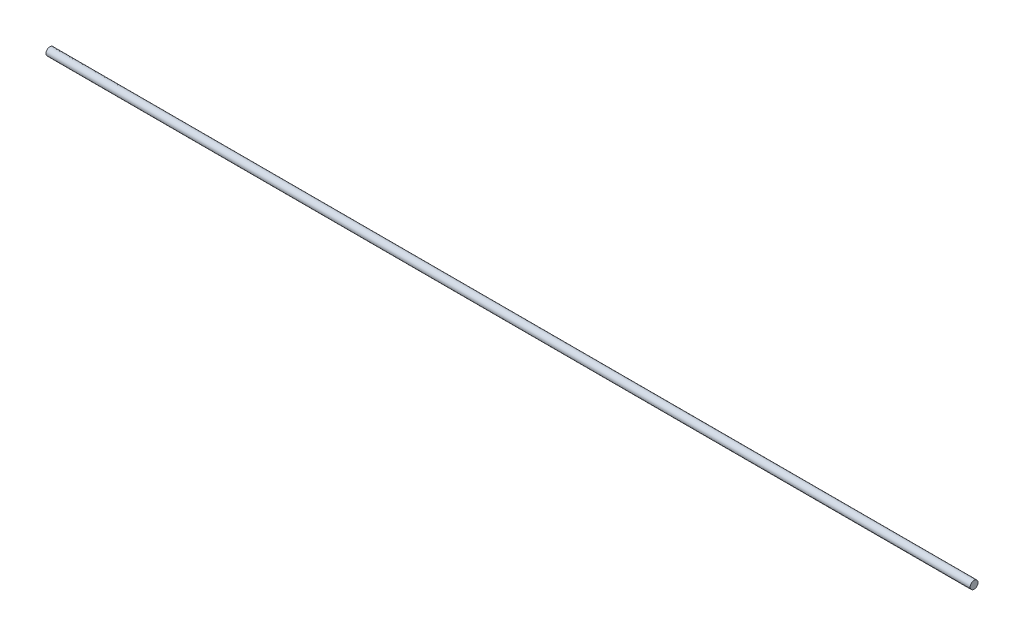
SolidWorks part; units mm, degrees
ref_plane "Front Plane" through (0, 0, 0) normal (1, 0, 0) x (0, 1, 0)
ref_plane "Top Plane" through (0, 0, 0) normal (0, 0, 1) x (0, 1, 0)
ref_plane "Right Plane" through (0, 0, 0) normal (0, 1, 0) x (-1, 0, 0)
sketch "Sketch1" plane through (0, 0, 0) normal (1, 0, 0) x (0, 1, 0)
  circle A0 centre (0, 0) radius 14.3256
  dimension "D1" = 28.6512
extrude "N9 - 2.257in - 11ft" add sketch "Sketch1" along normal mid plane 3380.7
ref_plane "6.9in offset 1" through (1515.475, 0, 0) normal (1, 0, 0) x (0, 1, 0)
ref_plane "6.9in offset 2" through (-1515.475, 0, 0) normal (-1, 0, 0) x (0, -1, 0)
